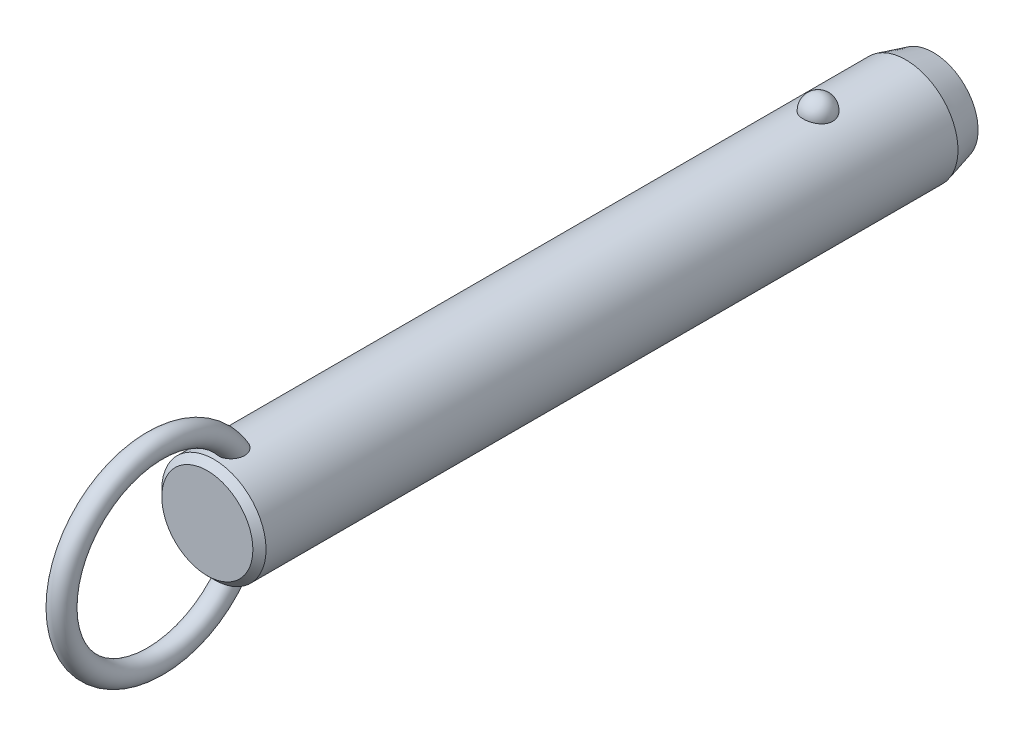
SolidWorks part; units mm, degrees
ref_plane "Front Plane" through (0, 0, 0) normal (0, 0, 1) x (1, 0, 0)
ref_plane "Top Plane" through (0, 0, 0) normal (0, 1, 0) x (1, 0, 0)
ref_plane "Right Plane" through (0, 0, 0) normal (1, 0, 0) x (0, 0, -1)
sketch "Sketch2" plane through (0, 0, 0) normal (0, 0, 1) x (1, 0, 0)
  circle A0 centre (0, 0) radius 9.5
  point P3 (0, 9.5)
  dimension "D1" = 19
extrude "Boss-Extrude1" add sketch "Sketch2" along normal blind 99.1
sketch "Sketch3" plane through (0, 0, 0) normal (0, 0, -1) x (-1, 0, 0)
  circle A0 centre (0, 0) radius 9.5
  dimension "D1" = 19
extrude "Boss-Extrude2" add sketch "Sketch3" along normal blind 23.7
chamfer "Chamfer1" distance 5 angle 15 1 edges at (-9.5, 0, -23.7)
sketch "Sketch12" plane through (0, 0, 0) normal (1, 0, 0) x (0, 0, -1)
  line L0 (-99.1, 9.5) -> (-99.1, -9.5) construction
  point P0 (-99.1, 0)
sketch "Sketch13" plane through (0, 0, 0) normal (1, 0, 0) x (0, 0, -1)
  circle A0 centre (-118.15, 0) radius 19.05
  point P2 (-99.1, 0)
  dimension "D1" = 38.1
sketch "Sketch14" plane through (0, 0, 0) normal (0, 1, 0) x (1, 0, 0)
  circle A0 centre (0, -101.1) radius 2
  point P2 (0, -99.1)
  dimension "D1" = 4
sweep "Sweep1" add profiles "Sketch14" path "Sketch13"
sketch "Sketch15" plane through (0, 0, 99.1) normal (0, 0, 1) x (1, 0, 0)
  circle A0 centre (0, 0) radius 9.5
  dimension "D1" = 19
extrude "Boss-Extrude3" add sketch "Sketch15" along normal blind 9.52
chamfer "Chamfer2" distance 1.2 angle 45 1 edges at (9.5, 0, 108.62)
sketch "Sketch18" plane through (0, 0, 0) normal (1, 0, 0) x (0, 0, -1)
  line L0 (18.7, 9.5) -> (-101.6378, 9.5) construction
  line L1 (2.7, 12.2) -> (2.7, 6.8)
  line L2 (-101.6378, -9.5) -> (18.7, -9.5) construction
  arc A0 (2.7, 12.2) -> (2.7, 6.8) centre (2.7, 9.5) ccw
  point P4 (0, 9.5)
  dimension "D1" = 21.7
revolve "Revolve1" add sketch "Sketch18" angle 360 about L1
